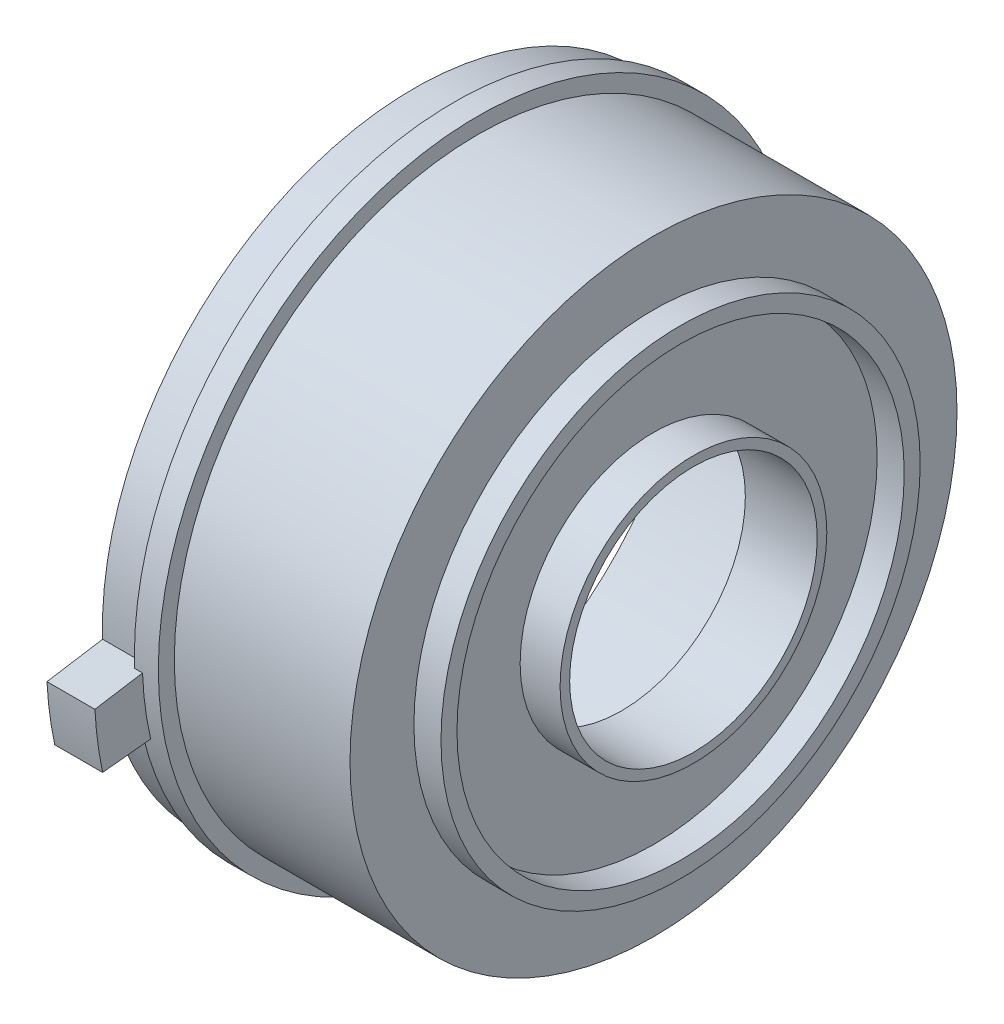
SolidWorks part; units mm, degrees
ref_plane "Face" through (0, 0, 0) normal (0, 0, 1) x (1, 0, 0)
ref_plane "Dessus" through (0, 0, 0) normal (0, 1, 0) x (1, 0, 0)
ref_plane "Droite" through (0, 0, 0) normal (1, 0, 0) x (0, 0, -1)
sketch "Esquisse1" plane through (0, 0, 0) normal (0, 0, 1) x (1, 0, 0)
  line L1 (101, 20) -> (101, 19)
  line L2 (97, 19.5) -> (97, 17.5)
  line L3 (112, 8.35) -> (112, 14)
  line L6 (0, 0) -> (116, 0) construction
  line L7 (112, 19) -> (101, 19)
  line L8 (97, 17.5) -> (110, 17.5)
  line L9 (99.5, 19.5) -> (97, 19.5)
  line L10 (99.5, 19.5) -> (99.5, 20)
  line L11 (99.5, 20) -> (101, 20)
  line L12 (110, 17.5) -> (110, 7.75)
  line L13 (110, 7.75) -> (114.5, 7.75)
  line L14 (112, 8.35) -> (114.5, 8.35)
  line L15 (114.5, 8.35) -> (114.5, 7.75)
  line L16 (112, 15) -> (113.6952, 15)
  line L17 (113.6952, 15) -> (113.6952, 14)
  line L18 (113.6952, 14) -> (112, 14)
  line L19 (112, 15) -> (112, 19)
  dimension "D1" = 0.5
  dimension "D2" = 1.5
  dimension "D3" = 35
  dimension "D4" = 15.5
  dimension "D5" = 15
  dimension "D6" = 13
  dimension "D7" = 0.6
  dimension "D8" = 2.5
  dimension "D9" = 30
  dimension "D10" = 28
  dimension "D11" = 1.6952
  dimension "D13" = 39
revolve "Base-Révolution" add sketch "Esquisse1" angle 360 about L6
sketch "Esquisse2" plane through (97, 0, 0) normal (-1, 0, 0) x (0, 0, 1)
  line L2 (22.9699, -1.1772) -> (18.9924, -0.5374)
  line L3 (18.4771, -4.427) -> (22.4839, -4.8451)
  line L4 (0, 0) -> (25.8509, -3.4251) construction
  line L5 (0, 0) -> (28, 0) construction
  arc A1 (22.4839, -4.8451) -> (22.9699, -1.1772) centre (0, 0) ccw
  arc A3 (18.4771, -4.427) -> (18.9924, -0.5374) centre (0, 0) ccw
  dimension "D3" = 23
  dimension "D5" = 19
  dimension "D1" = 7.547
  dimension "D2" = 3.9236
  dimension "D6" = 3.7
extrude "Boss.-Extru.1" add sketch "Esquisse2" against normal blind 3
